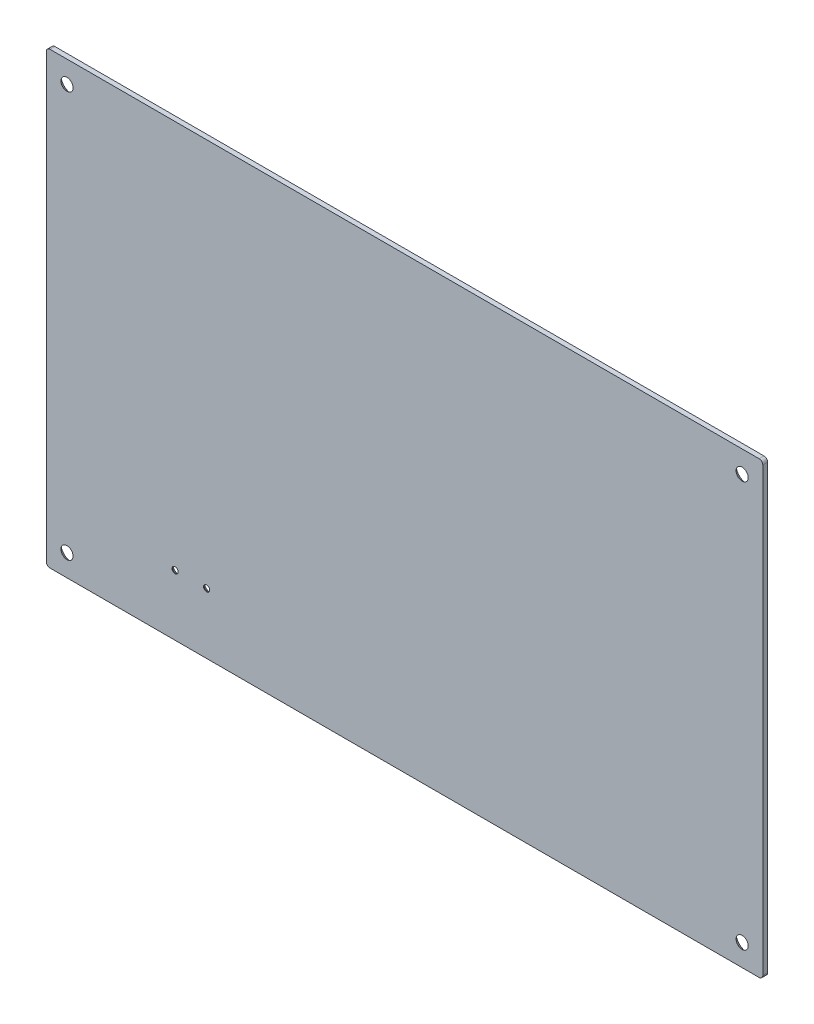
SolidWorks part; units mm, degrees
ref_plane "Front" through (0, 0, 0) normal (0, 0, 1) x (1, 0, 0)
ref_plane "Top" through (0, 0, 0) normal (0, 1, 0) x (1, 0, 0)
ref_plane "Right" through (0, 0, 0) normal (1, 0, 0) x (0, 0, -1)
sketch "Sketch1" plane through (0, 0, 0) normal (0, 0, 1) x (1, 0, 0)
  line L0 (147.5, -92.5) -> (-147.5, 92.5) construction
  line L1 (-146, 92.5) -> (146, 92.5)
  line L2 (-147.5, 91) -> (-147.5, -91)
  line L3 (-146, -92.5) -> (146, -92.5)
  line L4 (147.5, 91) -> (147.5, -91)
  arc A0 (146, -92.5) -> (147.5, -91) centre (146, -91) ccw
  arc A1 (146, 92.5) -> (147.5, 91) centre (146, 91) cw
  arc A2 (-147.5, 91) -> (-146, 92.5) centre (-146, 91) cw
  arc A3 (-146, -92.5) -> (-147.5, -91) centre (-146, -91) cw
  point P10 (147.5, 92.5)
  point P16 (-147.5, -92.5)
  dimension "D3" = 1.5
  dimension "D1" = 295
  dimension "D2" = 185
sheet metal parameters "Sheet-Metal1" thickness 2 parameters "D1"=0.7366
base flange "Base-Flange1" sketch "Sketch1" thickness 2 reverse thickness direction yes parameters "D1"=0.7366
sketch "Sketch8" plane through (0, 0, 2) normal (0, 0, 1) x (1, 0, 0)
  line L0 (-146, -92.5) -> (146, -92.5) construction
  line L1 (-147.5, 91) -> (-147.5, -91) construction
  circle A0 centre (-107.5, -67.5) radius 1.75
  circle A1 centre (-94.5, -67.5) radius 1.75
  dimension "D1" = 3.5
  dimension "D2" = 3.5
  dimension "D4" = 40
  dimension "D5" = 53
  dimension "D3" = 25
extrude "Cut-Extrude11" [suppressed] cut sketch "Sketch8" against normal through all
hole_wizard "Furo roscado de M41" positions "Esboço4" profile "Esboço3" tap size "M4" standard "ISO"
sketch "Esboço4" plane through (0, 0, 2) normal (0, 0, 1) x (1, 0, 0)
  line L0 (146, 92.5) -> (-146, 92.5) construction
  line L1 (-147.5, 91) -> (-147.5, -91) construction
  point P0 (-139, 83.5)
  dimension "D1" = 9
  dimension "D2" = 8.5
sketch "Esboço3" plane through (-139, 83.5, 2) normal (1, 0, 0) x (0, -1, 0)
  line L0 (0, 0) -> (0, 2)
  line L1 (0, 2) -> (4.5, 2)
  line L2 (1.65, -0.85) -> (1.65, 0)
  line L5 (1.65, 0) -> (0, 0)
  line L7 (4.5, 2) -> (1.65, -0.85)
  line L8 (-4.5, 2) -> (-1.65, -0.85) construction
  line L11 (0, -6.35) -> (0, 107.95) construction
  dimension "Thru Tap Drill Dia." = 3.3
  dimension "Thru Tap Drill Depth" = 2
  dimension "Far C'Sink Dia." = 9
  dimension "Far C'Sink Angle" = 90
mirror "Espelhar1" about plane through (0, 0, 0) normal (0, 1, 0) of "Furo roscado de M41"
mirror "Espelhar2" about plane through (0, 0, 0) normal (1, 0, 0) of "Espelhar1", "Furo roscado de M41"
hole_wizard "Furo roscado de M31" positions "Esboço6" profile "Esboço5" tap size "M3" standard "ISO"
sketch "Esboço6" plane through (0, 0, 2) normal (0, 0, 1) x (1, 0, 0)
  line L0 (-146, -92.5) -> (146, -92.5) construction
  line L1 (-147.5, 91) -> (-147.5, -91) construction
  point P0 (-94.5, -67.5)
  point P1 (-81.5, -67.5)
  dimension "D1" = 25
  dimension "D2" = 25
  dimension "D3" = 53
  dimension "D4" = 66
sketch "Esboço5" plane through (-94.5, -67.5, 2) normal (1, 0, 0) x (0, -1, 0)
  line L0 (0, 0) -> (0, 2)
  line L1 (0, 2) -> (3, 2)
  line L2 (1.25, 0.25) -> (1.25, 0)
  line L5 (1.25, 0) -> (0, 0)
  line L7 (3, 2) -> (1.25, 0.25)
  line L8 (-3, 2) -> (-1.25, 0.25) construction
  line L11 (0, -6.35) -> (0, 107.95) construction
  dimension "Thru Tap Drill Dia." = 2.5
  dimension "Thru Tap Drill Depth" = 2
  dimension "Far C'Sink Dia." = 6
  dimension "Far C'Sink Angle" = 90
flat pattern "Flat-Pattern1"
sketch "Bend-Lines1" plane through (0, 0, 0) normal (0, 1, 0) x (-1, 0, 0)
